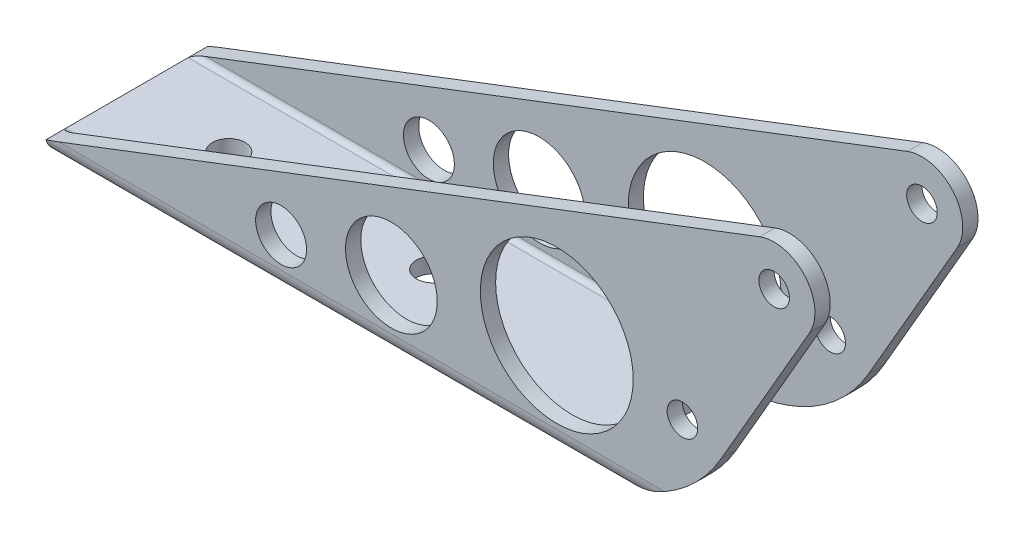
SolidWorks part; units mm, degrees
ref_plane "Plan1" through (0, 0, 0) normal (0, 0, 1) x (1, 0, 0)
ref_plane "Plan2" through (0, 0, 0) normal (0, 1, 0) x (1, 0, 0)
ref_plane "Plan3" through (0, 0, 0) normal (1, 0, 0) x (0, 0, -1)
sketch "Esquisse2" plane through (0, 0, 0) normal (1, 0, 0) x (0, 0, -1)
  line L0 (-16, 60) -> (-16, 4)
  line L1 (-12, 0) -> (12, 0)
  line L2 (16, 4) -> (16, 60)
  arc A0 (-16, 4) -> (-12, 0) centre (-12, 4) ccw
  arc A1 (12, 0) -> (16, 4) centre (12, 4) ccw
  dimension "D3" = 4
  dimension "D1" = 32
  dimension "D2" = 60
extrude "TOLE" add sketch "Esquisse2" along normal blind 160 thin
sketch "Esquisse4" plane through (0, 0, 0) normal (0, 0, 1) x (1, 0, 0)
  line L0 (0, 0) -> (106.5248, 0)
  line L1 (160, 0) -> (0, 0) construction
  line L2 (132.5056, 15) -> (149.9282, 45.1769)
  line L3 (140.1399, 56.6482) -> (0, 3)
  line L4 (0, 60) -> (0, 4) construction
  line L5 (0, 3) -> (0, 0)
  line L6 (143, 49.1769) -> (125, 18) construction
  line L7 (160, 3) -> (0, 3) construction
  arc A0 (106.5248, 0) -> (132.5056, 15) centre (106.5248, 30) ccw
  arc A1 (149.9282, 45.1769) -> (140.1399, 56.6482) centre (143, 49.1769) ccw
  dimension "D1" = 30
  dimension "D2" = 8
  dimension "D3" = 60
  dimension "D4" = 36
  dimension "D5" = 18
  dimension "D6" = 125
extrude "DECOUPE" cut sketch "Esquisse4" against normal through all and the other way through all flip side to cut
sketch "Esquisse5" plane through (0, 0, 0) normal (0, -1, 0) x (1, 0, 0)
  line L1 (149.9282, 13) -> (106.5248, 13)
  line L2 (149.9282, 13) -> (149.9282, -13)
  line L3 (149.9282, -13) -> (106.5248, -13)
  line L4 (106.5248, 13) -> (106.5248, -13)
  line L5 (106.5248, -12) -> (106.5248, 12) construction
  line L6 (149.9282, 13) -> (132.5056, 13) construction
  line L7 (132.5056, -13) -> (149.9282, -13) construction
  line L8 (149.9282, -16) -> (149.9282, -13) construction
extrude "DEGAGEMENT" cut sketch "Esquisse5" against normal through all
sketch "Esquisse6" plane through (0, 0, 16) normal (0, 0, 1) x (1, 0, 0)
  line L0 (19.2098, 5) -> (101.4721, 5) construction
  line L1 (19.2098, 5) -> (101.6404, 36.556) construction
  line L2 (140.1399, 56.6482) -> (2.6122, 4) construction
  line L3 (106.5248, 0) -> (0, 0) construction
  circle A0 centre (46.2561, 10) radius 5
  circle A1 centre (67.8932, 14) radius 9
  circle A2 centre (100.3488, 20) radius 15
  dimension "D3" = 30
  dimension "D4" = 18
  dimension "D5" = 10
  dimension "D1" = 5
  dimension "D2" = 5
extrude "Enlèv. mat.-Extru.3" cut sketch "Esquisse6" against normal through all
hole_wizard "PASSAGE AXE" positions "Esquisse8" profile "Esquisse7" hole size "M6.0" standard "ISO"
sketch "Esquisse8" plane through (0, 0, 16) normal (0, 0, 1) x (1, 0, 0)
  point P0 (143, 49.1769)
  point P1 (125, 18)
sketch "Esquisse7" plane through (143, 49.1769, 16) normal (1, 0, 0) x (0, -1, 0)
  line L0 (0, 0) -> (0, 32)
  line L1 (0, 32) -> (3, 32)
  line L2 (3, 32) -> (3, 0)
  line L5 (3, 0) -> (0, 0)
  line L11 (0, -6.35) -> (0, 107.95) construction
  dimension "Diamètre du perçage jusqu'au prochain" = 6
  dimension "Profondeur du perçage jusqu'au prochain" = 32
hole_wizard "PASSAGE M6" positions "Esquisse3D1" profile "Esquisse10" hole size "M6" standard "ISO"
sketch3d "Esquisse3D1"
  line L0 (0, 0, 12) -> (0, 0, -12) construction
  point P0 (20, 0, 0)
  point P1 (60, 0, 0)
  dimension "D1" = 20
  dimension "D2" = 40
sketch "Esquisse10" plane through (20, 0, 0) normal (1, 0, 0) x (0, 0, -1)
  line L0 (0, 0) -> (0, 57.1769)
  line L1 (0, 57.1769) -> (3.2, 57.1769)
  line L2 (3.2, 57.1769) -> (3.2, 0)
  line L5 (3.2, 0) -> (0, 0)
  line L11 (0, -6.35) -> (0, 107.95) construction
  dimension "Diamètre du perçage jusqu'au prochain" = 6.4
  dimension "Profondeur du perçage jusqu'au prochain" = 57.1769
